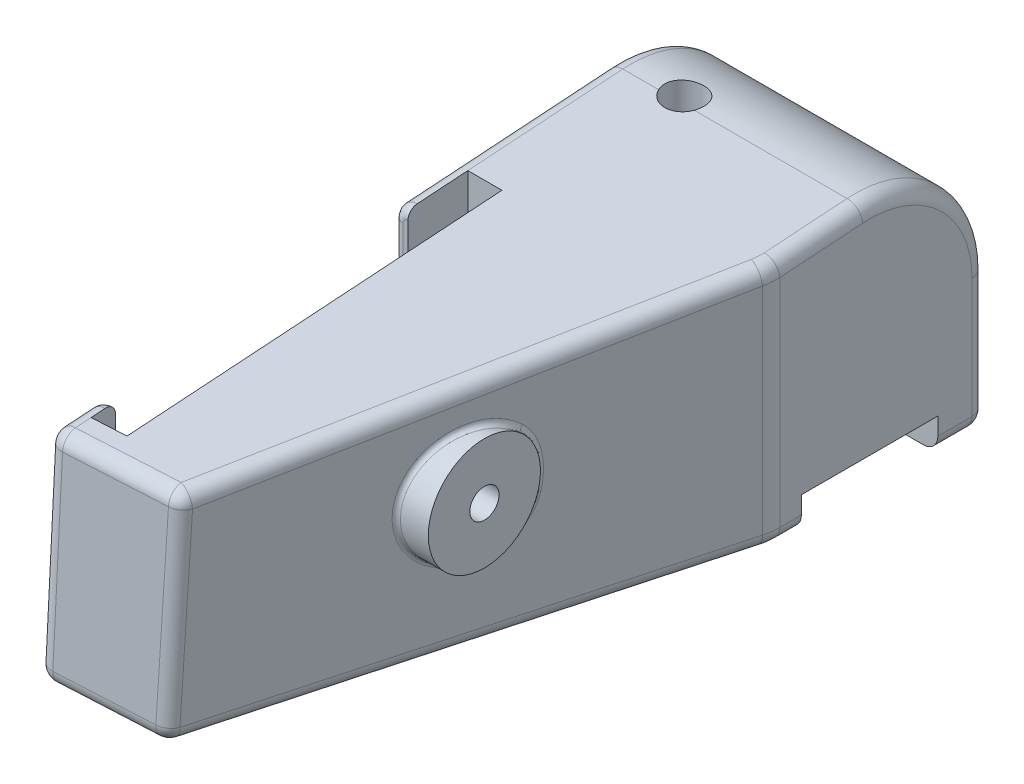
SolidWorks part; units mm, degrees
ref_plane "Face" through (0, 0, 0) normal (0, 0, 1) x (1, 0, 0)
ref_plane "Dessus" through (0, 0, 0) normal (0, 1, 0) x (1, 0, 0)
ref_plane "Droite" through (0, 0, 0) normal (1, 0, 0) x (0, 0, -1)
sketch "Esquisse1" plane through (0, 0, 0) normal (1, 0, 0) x (0, 0, -1)
  line L0 (-59.5, -13.8) -> (12, -13.8)
  line L1 (-59.5, 8) -> (-0.8104, 11.9726)
  line L2 (12, 0) -> (12, -13.8)
  line L3 (-59.5, 8) -> (-59.5, -13.8)
  arc A0 (12, 0) -> (-0.8104, 11.9726) centre (0, 0) ccw
  dimension "D1" = 24
  dimension "D3" = 13.8
  dimension "D2" = 71.5
  dimension "D4" = 21.8
extrude "Base-Extrusion" add sketch "Esquisse1" along normal blind 26
sketch "Esquisse2" plane through (0, -13.8, 0) normal (0, -1, 0) x (1, 0, 0)
  line L0 (26, 0.8104) -> (26, 59.5) construction
  line L1 (26, 10) -> (26, 59.5)
  line L2 (26, 59.5) -> (0, 59.5) construction
  line L3 (26, 59.5) -> (12.5, 59.5)
  line L4 (26, 10) -> (12.5, 59.5)
  line L5 (26, -12) -> (0, -12) construction
  dimension "D1" = 22
  dimension "D2" = 12.5
extrude "Enlèv. mat.-Extru.1" cut sketch "Esquisse2" against normal through all
sketch "Esquisse3" plane through (0, 0, 0) normal (-1, 0, 0) x (0, 0, 1)
  line L0 (14.1, 5.5525) -> (14.1, 0.65)
  line L1 (59.5, 8) -> (59.5, -13.8) construction
  line L2 (0.8104, 11.9726) -> (59.5, 8) construction
  line L3 (9.9789, 0.65) -> (14.1, 0.65)
  line L4 (9.9789, -0.65) -> (14.1, -0.65)
  line L5 (-14.0143, 0) -> (33.392, 0) construction
  line L6 (14.1, -0.65) -> (14.1, -10.8)
  line L7 (59.5, -13.8) -> (-12, -13.8) construction
  line L8 (7, -13.8) -> (-7, -13.8)
  line L9 (7, -10.8) -> (7, -13.8)
  line L10 (7, -10.8) -> (14.1, -10.8)
  line L11 (0, 0) -> (0, -22.2803) construction
  line L12 (-7, -10.8) -> (-7, -13.8)
  line L13 (-9, -4.3589) -> (-9, -10.8)
  line L14 (-9, -10.8) -> (-7, -10.8)
  line L15 (-12, -13.8) -> (-12, 0) construction
  line L16 (-2, -9.798) -> (-2, -10.8)
  line L17 (-2, -10.8) -> (2, -10.8)
  line L18 (2, -10.8) -> (2, -9.798)
  circle A0 centre (0, 0) radius 8
  arc A1 (9.9789, 0.65) -> (8.9919, 4.3756) centre (0, 0) ccw
  arc A2 (14.1, 5.5525) -> (8.9919, 4.3756) centre (11.4104, 5.5525) ccw
  arc A3 (-9, -4.3589) -> (-2, -9.798) centre (0, 0) ccw
  arc A4 (2, -9.798) -> (9.9789, -0.65) centre (0, 0) ccw
  dimension "D1" = 16
  dimension "D2" = 20
  dimension "D4" = 3
  dimension "D3" = 45.4
  dimension "D5" = 1.3
  dimension "D6" = 14
  dimension "D7" = 3
  dimension "D8" = 3
  dimension "D9" = 4
  dimension "D10" = 3
extrude "Enlèv. mat.-Extru.2" cut sketch "Esquisse3" against normal blind 23
sketch "Esquisse4" plane through (23, 0, 0) normal (-1, 0, 0) x (0, 0, 1)
  circle A0 centre (0, 0) radius 8 construction
  circle A1 centre (0, 0) radius 8
  circle A2 centre (0, 0) radius 7
  dimension "D1" = 14
extrude "Boss.-Extru.1" add sketch "Esquisse4" along normal blind 2
draft "Dépouille1" type of draft neutral plane draft angle 3 faces to draft 1 parameters "D1"=3
draft "Dépouille2" type of draft neutral plane draft angle 3 faces to draft 1 parameters "D1"=3
sketch "Esquisse5" plane through (0, -13.8, 0) normal (0, -1, 0) x (1, 0, 0)
  line L0 (-3.9911, 0) -> (31.719, 0) construction
  line L1 (26, 0) -> (0, 0) construction
  line L2 (0, 59.5) -> (0, 7) construction
  line L3 (0, 7) -> (0, 5)
  line L4 (23, 7) -> (0, 7) construction
  line L5 (3, 7) -> (0, 7)
  line L6 (23, -7) -> (0, -7) construction
  line L7 (3, -7) -> (0, -7)
  line L8 (3, 7) -> (3, 5)
  line L9 (0, 5) -> (3, 5)
  line L10 (0, -5) -> (3, -5)
  line L11 (0, -5) -> (0, -7)
  line L12 (3, -5) -> (3, -7)
  dimension "D1" = 3
  dimension "D2" = 10
extrude "Boss.-Extru.2" add sketch "Esquisse5" against normal up to surface (3 mm away)
fillet "Congé2" radius 6 1 edges at (26, -1.2247, 10)
fillet "Congé1" radius 1.5 18 edges at (26, -6.9, -12) (25.9469, 11.3511, 9.9929) (26, -13.8, -1.4018) (25.9469, -13.8, 9.9929) (26, 8.7671, -8.1938) (26, 11.6888, 5.0034) (6.4998, 8.1009, 58.01) (6.3406, -13.8, 59.1677) (12.8404, -2.838, 58.2518) (19.3941, 9.711, 34.2217) (19.2349, -13.8, 34.8053) (0, -13.8, -8.5) (0, 10.0252, 29.5811) (0, 8.7671, -8.1938) (0, -6.9, -12) (0, -13.8, 32.25) (0, -2.8611, 58.9259) (13, -13.8, -12)
sketch "Esquisse6" plane through (23, 0, 0) normal (-1, 0, 0) x (0, 0, 1)
  line L0 (-7, -13.8) -> (7, -13.8) construction
  line L1 (-7, -13.8) -> (7, -13.8)
  line L2 (7, -12.3) -> (7, -10.8) construction
  line L3 (7, -13.8) -> (7, -10.5)
  line L4 (-7, -10.8) -> (-7, -12.3) construction
  line L5 (-7, -10.5) -> (-7, -13.8)
  line L6 (-7, -10.5) -> (7, -10.5)
  dimension "D1" = 3.3
extrude "Enlèv. mat.-Extru.3" cut sketch "Esquisse6" against normal through all
sketch "Esquisse7" plane through (0, -13.8, 0) normal (0, -1, 0) x (1, 0, 0)
  line L0 (10.6578, 54.8531) -> (21.0632, 16.7)
  line L1 (12.6813, 58.8354) -> (26, 10) construction
  line L2 (8, 54.9924) -> (10.6578, 54.8531)
  line L3 (11.8723, 16.7) -> (21.0632, 16.7)
  line L4 (8, 54.9924) -> (8, 22.0541)
  line L6 (1.5784, 59.3344) -> (11.6203, 58.8082) construction
  line L7 (1.5, 55.3331) -> (5, 55.1496)
  line L8 (1.5, 55.3331) -> (1.5, 16.7)
  line L9 (1.5, 16.7) -> (5, 16.7)
  line L10 (5, 55.1496) -> (5, 16.7)
  line L11 (0, 5) -> (0, 57.8385) construction
  arc A0 (11.8723, 16.7) -> (8, 22.0541) centre (9, 18.7) ccw
  circle A1 centre (9, 18.7) radius 2
  dimension "D7" = 7
  dimension "D8" = 4
  dimension "D9" = 7
  dimension "D1" = 3
  dimension "D2" = 4
  dimension "D3" = 3
  dimension "D4" = 3.5
  dimension "D5" = 5
  dimension "D6" = 16.7
extrude "Enlèv. mat.-Extru.4" cut sketch "Esquisse7" against normal offset from surface (19.1051 mm away) 3
sketch "Esquisse8" plane through (0, -13.8, 0) normal (0, -1, 0) x (1, 0, 0)
  line L4 (1.5, 55.3331) -> (1.5, 16.7)
  line L5 (1.5, 16.7) -> (5, 16.7)
  line L6 (5, 16.7) -> (5, 55.1496)
  line L7 (5, 55.1496) -> (1.5, 55.3331)
  line L8 (1.5, 55.3331) -> (1.5, 16.7)
  line L9 (1.5, 16.7) -> (5, 16.7)
  line L10 (5, 16.7) -> (5, 55.1496)
  line L11 (5, 55.1496) -> (1.5, 55.3331)
  dimension "D1" = 0
extrude "Enlèv. mat.-Extru.7" cut sketch "Esquisse8" against normal through all
sketch "Esquisse9" plane through (0, 0, 0) normal (-1, 0, 0) x (0, 0, 1)
  line L0 (52.8344, 8.4512) -> (52.8344, -4.3)
  line L1 (52.8344, -4.3) -> (45.3344, -4.3)
  line L2 (45.3344, -4.3) -> (45.3344, -13.8)
  line L3 (55.3331, -13.8) -> (16.7, -13.8) construction
  line L4 (22.8344, -4.3) -> (22.8344, -13.8)
  line L5 (16.7, 3.2) -> (22.8344, 3.2)
  line L6 (55.3331, 8.2821) -> (16.7, 10.8971) construction
  line L7 (52.8344, 8.4512) -> (22.8344, 10.4818)
  line L8 (45.3344, -13.8) -> (22.8344, -13.8)
  line L9 (22.8344, 10.4818) -> (22.8344, 3.2)
  line L10 (16.7, 3.2) -> (16.7, -4.3)
  line L11 (16.7, -4.3) -> (22.8344, -4.3)
  line L12 (16.7, 10.8971) -> (16.7, -13.8) construction
  dimension "D1" = 14
  dimension "D2" = 7.5
  dimension "D3" = 9.5
  dimension "D4" = 30
  dimension "D5" = 7.5
extrude "Enlèv. mat.-Extru.6" cut sketch "Esquisse9" against normal up to next
sketch "Esquisse10" plane through (5, 0, 0) normal (-1, 0, 0) x (0, 0, 1)
  line L0 (34.5, 14.1426) -> (34.5, -13.7426) construction
  circle A0 centre (34.5, 0) radius 5.75
  dimension "D2" = 11.5
  dimension "D1" = 34.5
extrude "Boss.-Extru.3" add sketch "Esquisse10" against normal blind 16
sketch "Esquisse11" plane through (5, 0, 0) normal (-1, 0, 0) x (0, 0, 1)
  line L0 (10.7752, 9.8214) -> (56.6947, 6.7132) construction
  line L1 (28.75, 8.6047) -> (40.25, 7.8263)
  line L2 (28.75, 8.6047) -> (28.75, 0)
  line L3 (40.25, 7.8263) -> (40.25, 0)
  circle A0 centre (34.5, 0) radius 5.75 construction
  arc A1 (28.75, 0) -> (40.25, 0) centre (34.5, 0) ccw
extrude "Boss.-Extru.4" add sketch "Esquisse11" against normal up to surface (9.6404 mm away)
sketch "Esquisse12" plane through (5, 0, 0) normal (-1, 0, 0) x (0, 0, 1)
  line L0 (34.5, 18.6942) -> (34.5, -20.3832) construction
  line L2 (10.7752, 9.8214) -> (56.6947, 6.7132) construction
  line L3 (23, 8.9939) -> (46, 7.4371)
  line L4 (46, 7.4371) -> (46, 1.75)
  line L5 (23, 8.9939) -> (23, 1.75)
  arc A0 (23, 1.75) -> (46, 1.75) centre (34.5, 1.75) ccw
  arc A1 (28.75, 0) -> (40.25, 0) centre (34.5, 0) ccw construction
  dimension "D2" = 4
  dimension "D3" = 23
  dimension "D1" = 34.5
extrude "Boss.-Extru.5" add sketch "Esquisse12" against normal blind 7
sketch "Esquisse13" plane through (21, 0, 0) normal (1, 0, 0) x (0, 0, -1)
  circle A0 centre (-34.5, 0) radius 1.5
  circle A1 centre (-34.5, 0) radius 5.75 construction
  dimension "D1" = 3
extrude "Enlèv. mat.-Extru.8" cut sketch "Esquisse13" against normal up to next
sketch "Esquisse14" plane through (5, 0, 0) normal (-1, 0, 0) x (0, 0, 1)
  circle A0 centre (34.5, 0) radius 6.5
  circle A1 centre (34.5, 0) radius 1.5 construction
  dimension "D1" = 13
extrude "Enlèv. mat.-Extru.9" cut sketch "Esquisse14" against normal offset from surface (4.5 mm away) 2.5
sketch "Esquisse15" plane through (0, 0, 0) normal (0, 1, 0) x (1, 0, 0)
  circle A0 centre (7, 0) radius 2
  dimension "D1" = 4
  dimension "D2" = 7
extrude "Enlèv. mat.-Extru.10" cut sketch "Esquisse15" along normal through all
sketch "Esquisse16" plane through (0, 0, 0) normal (0, 1, 0) x (1, 0, 0)
  circle A0 centre (7, 0) radius 1.5
  arc A1 (8.8285, -0.8104) -> (5.1715, -0.8104) centre (7, 0) ccw construction
  dimension "D1" = 3
extrude "Enlèv. mat.-Extru.11" cut sketch "Esquisse16" along normal up to surface (10.8 mm away)
fillet "Congé3" radius 1 18 edges at (0.75, -4.3, 16.7) (0.4393, -13.3607, 22.8344) (0.75, -4.3, 22.8344) (0.75, 3.2, 16.7) (0.4393, 10.0415, 22.8344) (0.75, 3.2, 22.8344) (0, 6.0892, 22.8344) (0, 3.2, 19.7672) (0, -0.55, 16.7) (0, -4.3, 19.7672) (0, -8.3, 22.8344) (0, -8.3, 45.3344) (0, -4.3, 49.0844) (0, 1.3239, 52.8344) (0.4393, 8.0108, 52.8344) (0.75, -4.3, 52.8344) (0.4393, -13.3607, 45.3344) (0.75, -4.3, 45.3344)
fillet "Congé4" radius 0.5 24 edges at (8, -4.2474, 54.9924) (10.6578, -4.2427, 54.8531) (21.0632, -2.9515, 16.7) (11.8723, -2.9515, 16.7) (11.836, 7.6228, 20.7511) (17.75, 0, 40.25) (16.2086, -5.75, 34.5) (17.7768, 3.5407, 28.75) (14.6404, 3.1515, 40.25) (12, 3.5407, 28.75) (12, -9.75, 34.5) (8, 4.6103, 23) (12, 3.8319, 46) (12, 3.1515, 40.25) (12, -5.75, 34.5) (8, -9.75, 34.5) (12, 4.6103, 23) (8, 3.8319, 46) (23, 8.1734, 10.8065) (23, 3.1012, 14.1) (23, 0.65, 12.0394) (11.5, 0.65, 14.1) (11.5, 0.65, 9.9789) (11.5, -4.3589, -9)
fillet "Congé5" radius 0.5 6 edges at (8, -3.1327, 22.0541) (8, 7.5196, 22.2771) (8.1464, 7.4805, 22.8536) (8.5, 4.6103, 23) (8, 4.6272, 22.5) (8.1464, 1.75, 22.8536)
fillet "Congé6" radius 0.5 24 edges at (13.2429, 6.303, 40.25) (10, 5.9138, 46) (12, 6.1084, 43.125) (12.6105, 5.7992, 47.6929) (9.4114, 5.3101, 54.9184) (8, 5.6104, 50.4828) (10.5843, 5.3207, 54.762) (8.1558, 5.3162, 54.8282) (8.1464, 5.9039, 46.1464) (12.1464, 6.2931, 40.3964) (14.3832, 6.2897, 40.4465) (19.3841, 7.4803, 22.8566) (14.9474, 7.0814, 28.75) (12.1749, 7.662, 20.1731) (16.5583, 7.8971, 16.7) (12, 7.276, 25.875) (12.2935, 7.8821, 16.9205) (20.8059, 7.8838, 16.8965) (12.1464, 7.0913, 28.6036) (17.6984, 7.0884, 28.6474) (11.8536, 7.4607, 23.1464) (11.8536, 5.9237, 45.8536) (10.8745, 7.4706, 23) (9.7553, 7.4991, 22.5791)
fillet "Congé7" radius 0.3 19 edges at (23, -10.149, -2) (23, -10.65, -7) (23, -10.65, 7) (23, -8.4822, -9) (23, -5.6888, -8.6543) (23, -10.8, -8) (11.5, -10.8, -9) (23, -8.4063, -5.4161) (11.5, -9.798, -2) (23, -10.149, 2) (23, -6.5731, 7.5362) (11.5, -9.798, 2) (23, -0.65, 12.0394) (11.5, -0.65, 9.9789) (23, -5.725, 14.1) (11.5, -0.65, 14.1) (23, -10.8, 10.55) (11.5, -10.8, 14.1) (23, 0, 7)
